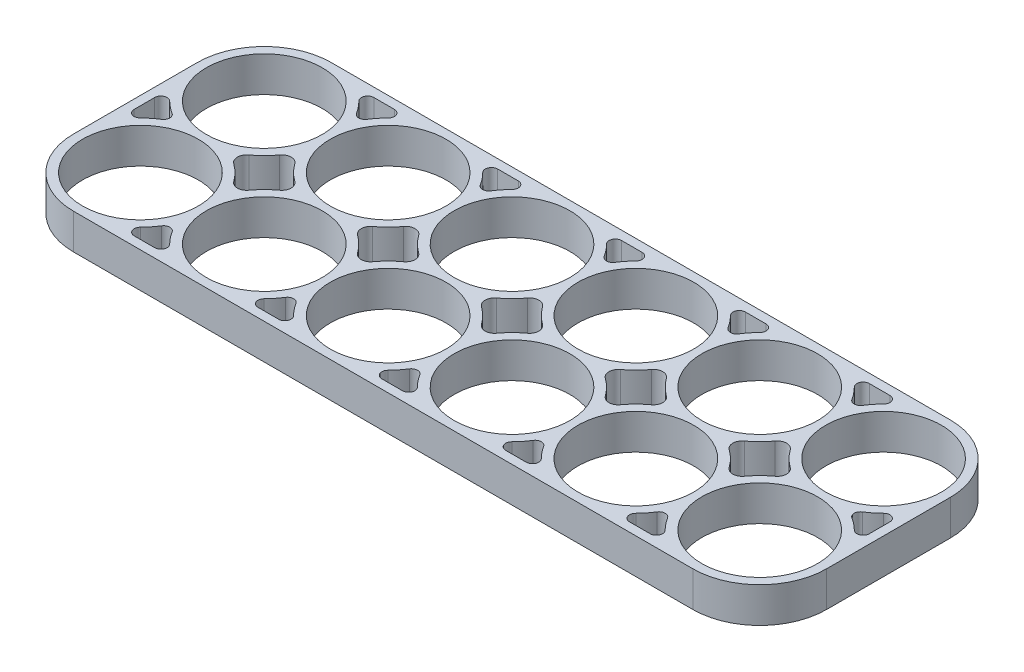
SolidWorks part; units mm, degrees
ref_plane "Ebene vorne" through (0, 0, 0) normal (0, 0, 1) x (1, 0, 0)
ref_plane "Ebene oben" through (0, 0, 0) normal (0, 1, 0) x (1, 0, 0)
ref_plane "Ebene rechts" through (0, 0, 0) normal (1, 0, 0) x (0, 0, -1)
sketch "Skizze1" plane through (0, 0, 0) normal (0, 1, 0) x (1, 0, 0)
  line L0 (-21.6623, -19.35) -> (-18.3377, -19.35)
  line L1 (-1.6623, -19.35) -> (1.6623, -19.35)
  line L2 (-50, 0) -> (50, 0) construction
  line L3 (0, -50) -> (0, 50) construction
  line L4 (-60.8, 10) -> (-60.8, -10)
  line L5 (-60.8, -10) -> (-59.35, -10)
  line L6 (-59.35, -1.6623) -> (-59.35, 1.6623)
  line L7 (-50, -20.8) -> (50, -20.8)
  line L8 (-41.6623, -19.35) -> (-38.3377, -19.35)
  line L9 (18.3377, -19.35) -> (21.6623, -19.35)
  line L10 (38.3377, -19.35) -> (41.6623, -19.35)
  line L11 (60.8, 10) -> (60.8, -10)
  line L13 (59.35, -1.6623) -> (59.35, 1.6623)
  line L14 (-50, 20.8) -> (50, 20.8)
  line L15 (-41.6623, 19.35) -> (-38.3377, 19.35)
  line L16 (-21.6623, 19.35) -> (-18.3377, 19.35)
  line L17 (-1.6623, 19.35) -> (1.6623, 19.35)
  line L18 (18.3377, 19.35) -> (21.6623, 19.35)
  line L19 (38.3377, 19.35) -> (41.6623, 19.35)
  circle A0 centre (-50, 10) radius 9.35
  circle A1 centre (-30, 10) radius 9.35
  circle A2 centre (-10, 10) radius 9.35
  circle A3 centre (10, 10) radius 9.35
  circle A4 centre (30, 10) radius 9.35
  circle A5 centre (50, 10) radius 9.35
  circle A6 centre (50, -10) radius 9.35
  circle A7 centre (30, -10) radius 9.35
  circle A8 centre (10, -10) radius 9.35
  circle A9 centre (-10, -10) radius 9.35
  circle A10 centre (-30, -10) radius 9.35
  circle A11 centre (-50, -10) radius 9.35
  arc A12 (-40.8475, 15.7333) -> (-42.3689, 17.6424) centre (-50, 10) ccw
  arc A13 (-38.7805, 3.7117) -> (-36.2883, 1.2195) centre (-30, 10) ccw
  arc A14 (-18.7805, 3.7117) -> (-16.2883, 1.2195) centre (-10, 10) ccw
  arc A15 (1.2195, 3.7117) -> (3.7117, 1.2195) centre (10, 10) ccw
  arc A16 (21.2195, 3.7117) -> (23.7117, 1.2195) centre (30, 10) ccw
  arc A17 (41.2195, 3.7117) -> (43.7117, 1.2195) centre (50, 10) ccw
  arc A18 (40.8475, -15.7333) -> (42.3689, -17.6424) centre (50, -10) ccw
  arc A19 (20.8475, -15.7333) -> (22.3689, -17.6424) centre (30, -10) ccw
  arc A20 (0.8475, -15.7333) -> (2.3689, -17.6424) centre (10, -10) ccw
  arc A21 (-19.1525, -15.7333) -> (-17.6311, -17.6424) centre (-10, -10) ccw
  arc A22 (-39.1525, -15.7333) -> (-37.6311, -17.6424) centre (-30, -10) ccw
  arc A23 (-41.2195, -3.7117) -> (-43.7117, -1.2195) centre (-50, -10) ccw
  arc A24 (-20.8475, 15.7333) -> (-22.3689, 17.6424) centre (-30, 10) ccw
  arc A25 (-0.8475, 15.7333) -> (-2.3689, 17.6424) centre (-10, 10) ccw
  arc A26 (19.1525, 15.7333) -> (17.6311, 17.6424) centre (10, 10) ccw
  arc A27 (39.1525, 15.7333) -> (37.6311, 17.6424) centre (30, 10) ccw
  arc A28 (-21.2195, -3.7117) -> (-23.7117, -1.2195) centre (-30, -10) ccw
  arc A29 (-1.2195, -3.7117) -> (-3.7117, -1.2195) centre (-10, -10) ccw
  arc A30 (18.7805, -3.7117) -> (16.2883, -1.2195) centre (10, -10) ccw
  arc A31 (38.7805, -3.7117) -> (36.2883, -1.2195) centre (30, -10) ccw
  arc A32 (-55.7333, -0.8475) -> (-57.6424, -2.3689) centre (-50, -10) ccw
  arc A33 (-43.7117, 1.2195) -> (-41.2195, 3.7117) centre (-50, 10) ccw
  arc A34 (-36.2883, -1.2195) -> (-38.7805, -3.7117) centre (-30, -10) ccw
  arc A35 (-16.2883, -1.2195) -> (-18.7805, -3.7117) centre (-10, -10) ccw
  arc A36 (-23.7117, 1.2195) -> (-21.2195, 3.7117) centre (-30, 10) ccw
  arc A37 (-3.7117, 1.2195) -> (-1.2195, 3.7117) centre (-10, 10) ccw
  arc A38 (3.7117, -1.2195) -> (1.2195, -3.7117) centre (10, -10) ccw
  arc A39 (23.7117, -1.2195) -> (21.2195, -3.7117) centre (30, -10) ccw
  arc A40 (16.2883, 1.2195) -> (18.7805, 3.7117) centre (10, 10) ccw
  arc A41 (43.7117, -1.2195) -> (41.2195, -3.7117) centre (50, -10) ccw
  arc A42 (36.2883, 1.2195) -> (38.7805, 3.7117) centre (30, 10) ccw
  arc A43 (-60.8, -10) -> (-50, -20.8) centre (-50, -10) ccw
  arc A44 (55.7333, 0.8475) -> (57.6424, 2.3689) centre (50, 10) ccw
  arc A45 (-57.6424, 2.3689) -> (-55.7333, 0.8475) centre (-50, 10) ccw
  arc A46 (-42.3689, -17.6424) -> (-40.8475, -15.7333) centre (-50, -10) ccw
  arc A47 (-22.3689, -17.6424) -> (-20.8475, -15.7333) centre (-30, -10) ccw
  arc A48 (-2.3689, -17.6424) -> (-0.8475, -15.7333) centre (-10, -10) ccw
  arc A49 (17.6311, -17.6424) -> (19.1525, -15.7333) centre (10, -10) ccw
  arc A50 (37.6311, -17.6424) -> (39.1525, -15.7333) centre (30, -10) ccw
  arc A51 (50, -20.8) -> (60.8, -10) centre (50, -10) ccw
  arc A52 (60.8, 10) -> (50, 20.8) centre (50, 10) ccw
  arc A53 (57.6424, -2.3689) -> (55.7333, -0.8475) centre (50, -10) ccw
  arc A54 (-50, 20.8) -> (-60.8, 10) centre (-50, 10) ccw
  arc A55 (-37.6311, 17.6424) -> (-39.1525, 15.7333) centre (-30, 10) ccw
  arc A56 (-17.6311, 17.6424) -> (-19.1525, 15.7333) centre (-10, 10) ccw
  arc A57 (2.3689, 17.6424) -> (0.8475, 15.7333) centre (10, 10) ccw
  arc A58 (22.3689, 17.6424) -> (20.8475, 15.7333) centre (30, 10) ccw
  arc A59 (42.3689, 17.6424) -> (40.8475, 15.7333) centre (50, 10) ccw
  arc A60 (-59.35, -1.6623) -> (-57.6424, -2.3689) centre (-58.35, -1.6623) ccw
  arc A61 (-55.7333, -0.8475) -> (-55.7333, 0.8475) centre (-56.2642, 0) ccw
  arc A62 (-57.6424, 2.3689) -> (-59.35, 1.6623) centre (-58.35, 1.6623) ccw
  arc A63 (57.6424, -2.3689) -> (59.35, -1.6623) centre (58.35, -1.6623) ccw
  arc A64 (59.35, 1.6623) -> (57.6424, 2.3689) centre (58.35, 1.6623) ccw
  arc A65 (55.7333, -0.8475) -> (55.7333, 0.8475) centre (56.2642, 0) cw
  arc A66 (38.3377, -19.35) -> (37.6311, -17.6424) centre (38.3377, -18.35) cw
  arc A67 (41.6623, -19.35) -> (42.3689, -17.6424) centre (41.6623, -18.35) ccw
  arc A68 (40.8475, -15.7333) -> (39.1525, -15.7333) centre (40, -16.2642) ccw
  arc A69 (18.3377, -19.35) -> (17.6311, -17.6424) centre (18.3377, -18.35) cw
  arc A70 (21.6623, -19.35) -> (22.3689, -17.6424) centre (21.6623, -18.35) ccw
  arc A71 (20.8475, -15.7333) -> (19.1525, -15.7333) centre (20, -16.2642) ccw
  arc A72 (-1.6623, -19.35) -> (-2.3689, -17.6424) centre (-1.6623, -18.35) cw
  arc A73 (1.6623, -19.35) -> (2.3689, -17.6424) centre (1.6623, -18.35) ccw
  arc A74 (0.8475, -15.7333) -> (-0.8475, -15.7333) centre (0, -16.2642) ccw
  arc A75 (-19.1525, -15.7333) -> (-20.8475, -15.7333) centre (-20, -16.2642) ccw
  arc A76 (-18.3377, -19.35) -> (-17.6311, -17.6424) centre (-18.3377, -18.35) ccw
  arc A77 (-21.6623, -19.35) -> (-22.3689, -17.6424) centre (-21.6623, -18.35) cw
  arc A78 (-41.6623, -19.35) -> (-42.3689, -17.6424) centre (-41.6623, -18.35) cw
  arc A79 (-38.3377, -19.35) -> (-37.6311, -17.6424) centre (-38.3377, -18.35) ccw
  arc A80 (-39.1525, -15.7333) -> (-40.8475, -15.7333) centre (-40, -16.2642) ccw
  arc A81 (39.1525, 15.7333) -> (40.8475, 15.7333) centre (40, 16.2642) ccw
  arc A82 (42.3689, 17.6424) -> (41.6623, 19.35) centre (41.6623, 18.35) ccw
  arc A83 (37.6311, 17.6424) -> (38.3377, 19.35) centre (38.3377, 18.35) cw
  arc A84 (19.1525, 15.7333) -> (20.8475, 15.7333) centre (20, 16.2642) ccw
  arc A85 (22.3689, 17.6424) -> (21.6623, 19.35) centre (21.6623, 18.35) ccw
  arc A86 (17.6311, 17.6424) -> (18.3377, 19.35) centre (18.3377, 18.35) cw
  arc A87 (-0.8475, 15.7333) -> (0.8475, 15.7333) centre (0, 16.2642) ccw
  arc A88 (-40.8475, 15.7333) -> (-39.1525, 15.7333) centre (-40, 16.2642) ccw
  arc A89 (-20.8475, 15.7333) -> (-19.1525, 15.7333) centre (-20, 16.2642) ccw
  arc A90 (-2.3689, 17.6424) -> (-1.6623, 19.35) centre (-1.6623, 18.35) cw
  arc A91 (2.3689, 17.6424) -> (1.6623, 19.35) centre (1.6623, 18.35) ccw
  arc A92 (-17.6311, 17.6424) -> (-18.3377, 19.35) centre (-18.3377, 18.35) ccw
  arc A93 (-22.3689, 17.6424) -> (-21.6623, 19.35) centre (-21.6623, 18.35) cw
  arc A94 (-37.6311, 17.6424) -> (-38.3377, 19.35) centre (-38.3377, 18.35) ccw
  arc A95 (-41.6623, 19.35) -> (-42.3689, 17.6424) centre (-41.6623, 18.35) ccw
  arc A96 (-21.2195, -3.7117) -> (-18.7805, -3.7117) centre (-20, -2.8383) ccw
  arc A97 (-16.2883, -1.2195) -> (-16.2883, 1.2195) centre (-17.1617, 0) ccw
  arc A98 (-23.7117, -1.2195) -> (-23.7117, 1.2195) centre (-22.8383, 0) cw
  arc A99 (-41.2195, -3.7117) -> (-38.7805, -3.7117) centre (-40, -2.8383) ccw
  arc A100 (-36.2883, -1.2195) -> (-36.2883, 1.2195) centre (-37.1617, 0) ccw
  arc A101 (-43.7117, -1.2195) -> (-43.7117, 1.2195) centre (-42.8383, 0) cw
  arc A102 (43.7117, -1.2195) -> (43.7117, 1.2195) centre (42.8383, 0) ccw
  arc A103 (41.2195, -3.7117) -> (38.7805, -3.7117) centre (40, -2.8383) cw
  arc A104 (21.2195, -3.7117) -> (18.7805, -3.7117) centre (20, -2.8383) cw
  arc A105 (-1.2195, -3.7117) -> (1.2195, -3.7117) centre (0, -2.8383) ccw
  arc A106 (3.7117, -1.2195) -> (3.7117, 1.2195) centre (2.8383, 0) ccw
  arc A107 (23.7117, -1.2195) -> (23.7117, 1.2195) centre (22.8383, 0) ccw
  arc A108 (36.2883, -1.2195) -> (36.2883, 1.2195) centre (37.1617, 0) cw
  arc A109 (-3.7117, -1.2195) -> (-3.7117, 1.2195) centre (-2.8383, 0) cw
  arc A110 (16.2883, -1.2195) -> (16.2883, 1.2195) centre (17.1617, 0) cw
  arc A111 (41.2195, 3.7117) -> (38.7805, 3.7117) centre (40, 2.8383) ccw
  arc A112 (21.2195, 3.7117) -> (18.7805, 3.7117) centre (20, 2.8383) ccw
  arc A113 (1.2195, 3.7117) -> (-1.2195, 3.7117) centre (0, 2.8383) ccw
  arc A114 (-21.2195, 3.7117) -> (-18.7805, 3.7117) centre (-20, 2.8383) cw
  arc A115 (-38.7805, 3.7117) -> (-41.2195, 3.7117) centre (-40, 2.8383) ccw
  point P97 (-54.0792, 0)
  point P100 (-59.35, 4.5947)
  point P133 (-44.5947, -19.35)
  point P196 (-5.9208, 0)
  point P205 (0, 5.9208)
  dimension "D1" = 18.7
  dimension "D2" = 21.6
  dimension "D9" = 1
  dimension "D10" = 1.5
  dimension "D11" = 10.8
  dimension "D13" = 10.8
  dimension "D14" = 10.8
  dimension "D15" = 10.8
  dimension "D3" = 20
  dimension "D4" = 20
  dimension "D5" = 20
  dimension "D6" = 20
  dimension "D7" = 20
  dimension "D8" = 20
  dimension "D12" = 20
extrude "Aufsatz-Linear austragen1" add sketch "Skizze1" along normal blind 5.7
